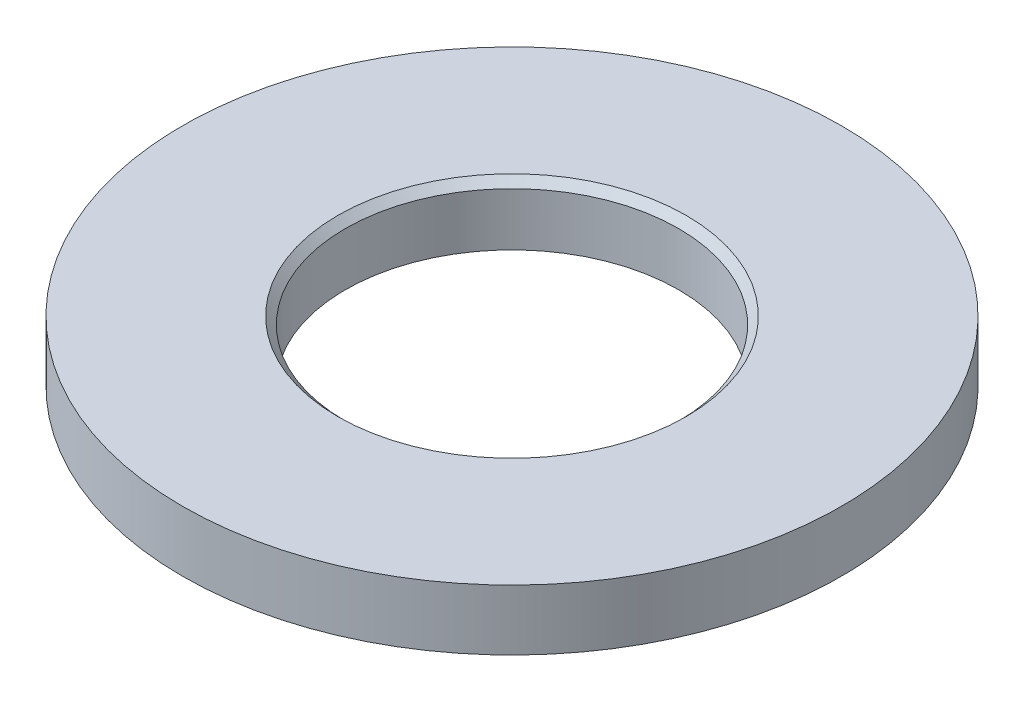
SolidWorks part; units mm, degrees
ref_plane "Front" through (0, 0, 0) normal (0, 0, 1) x (1, 0, 0)
ref_plane "Top" through (0, 0, 0) normal (0, 1, 0) x (1, 0, 0)
ref_plane "Right" through (0, 0, 0) normal (1, 0, 0) x (0, 0, -1)
sketch "Sketch1" plane through (0, 0, 0) normal (0, 1, 0) x (1, 0, 0)
  circle A0 centre (0, 0) radius 2.2
  circle A1 centre (0, 0) radius 4.35
  dimension "D1" = 4.4
  dimension "D2" = 8.7
extrude "Extrude1" add sketch "Sketch1" along normal blind 0.8
chamfer "Chamfer1" distance 0.1 angle 45
